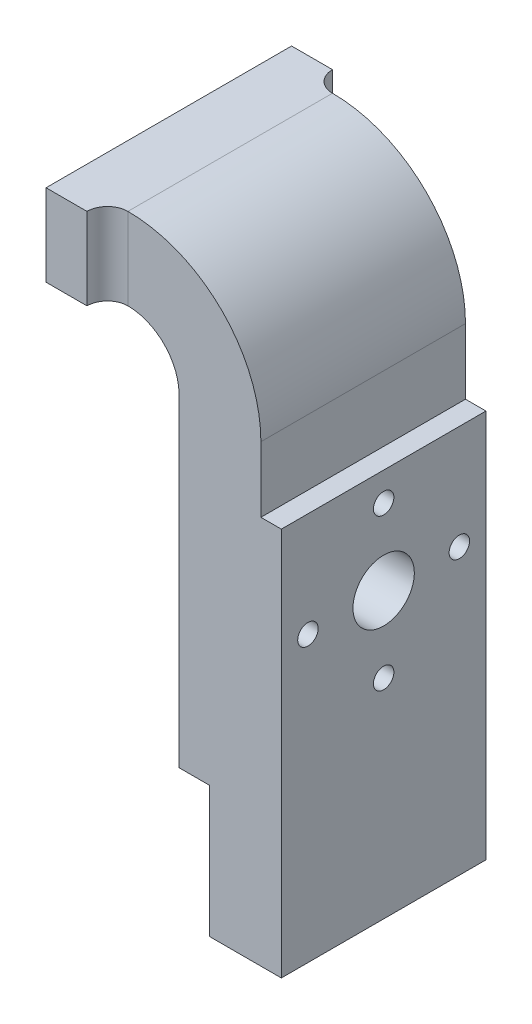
SolidWorks part; units mm, degrees
ref_plane "Front Plane" through (0, 0, 0) normal (0, 0, 1) x (1, 0, 0)
ref_plane "Top Plane" through (0, 0, 0) normal (0, 1, 0) x (1, 0, 0)
ref_plane "Right Plane" through (0, 0, 0) normal (1, 0, 0) x (0, 0, -1)
sketch "Sketch1" plane through (0, 0, 0) normal (0, 0, 1) x (1, 0, 0)
  line L0 (132.5, 64) -> (147.5, 64)
  line L1 (132.5, 222) -> (132.5, 64)
  line L2 (147.5, 0) -> (182.5, 0)
  line L3 (182.5, 190) -> (182.5, 0)
  line L4 (172.5, 222) -> (172.5, 190)
  line L5 (172.5, 190) -> (182.5, 190)
  line L6 (107.5, 287) -> (77.5, 287)
  line L7 (77.5, 287) -> (77.5, 247)
  line L8 (77.5, 247) -> (107.5, 247)
  line L9 (147.5, 64) -> (147.5, 0)
  line L10 (147.5, 0) -> (147.5, 64) construction
  line L11 (147.5, 64) -> (127.5, 64) construction
  line L14 (-147.5, 0) -> (147.5, 0) construction
  arc A0 (132.5, 222) -> (107.5, 247) centre (107.5, 222) ccw
  arc A1 (172.5, 222) -> (107.5, 287) centre (107.5, 222) ccw
  dimension "D1" = 50
  dimension "D2" = 65
  dimension "D3" = 30
  dimension "D4" = 15
  dimension "D5" = 35
  dimension "D6" = 190
  dimension "D9" = 32
extrude "Boss-Extrude1" add sketch "Sketch1" along normal mid plane 100
sketch "Sketch2" plane through (0, 0, 50) normal (0, 0, 1) x (1, 0, 0)
  line L0 (77.5, 247) -> (107.5, 247) construction
  line L1 (77.5, 287) -> (97.5, 287)
  line L2 (77.5, 287) -> (77.5, 247)
  line L3 (77.5, 247) -> (97.5, 247)
  line L4 (97.5, 287) -> (97.5, 247)
  dimension "D1" = 20
extrude "Boss-Extrude2" add sketch "Sketch2" along normal blind 10
mirror "Mirror1" about plane through (0, 0, 0) normal (0, 0, 1) of "Boss-Extrude2"
fillet "Fillet1" radius 10 2 edges
hole_wizard "M12x1.5 Tapped Hole1" positions "Sketch6" profile "Sketch5" tap size "M12x1.5" standard "ANSI Metric"
sketch "Sketch6" plane through (77.5, 0, 0) normal (-1, 0, 0) x (0, 0, 1)
  line L0 (0, 0) -> (0, 276.3928) construction
  line L2 (60, 287) -> (-60, 287) construction
  point P0 (-35, 267)
  point P2 (35, 267)
  dimension "D1" = 70
  dimension "D2" = 20
sketch "Sketch5" plane through (77.5, 267, -35) normal (0, 1, 0) x (0, 0, 1)
  line L0 (0, 0) -> (0, 31.6545)
  line L1 (0, 31.6545) -> (5.25, 28.5)
  line L2 (5.25, 28.5) -> (5.25, 0)
  line L5 (5.25, 0) -> (0, 0)
  line L10 (0, 31.6545) -> (-5.25, 28.5) construction
  line L11 (0, -6.35) -> (0, 107.95) construction
  dimension "Tap Drill Dia." = 10.5
  dimension "Tap Drill Depth" = 28.5
  dimension "Drill Angle" = 118
sketch "Sketch7" plane through (182.5, 0, 0) normal (1, 0, 0) x (0, 0, -1)
  circle A0 centre (0, 139) radius 15 construction
  circle A1 centre (0, 139) radius 15
extrude "Cut-Extrude1" cut sketch "Sketch7" against normal through all
sketch "Sketch8" plane through (182.5, 0, 0) normal (1, 0, 0) x (0, 0, -1)
  circle A4 centre (0, 102) radius 5
  circle A5 centre (-37, 139) radius 5
  circle A6 centre (0, 176) radius 5
  circle A7 centre (37, 139) radius 5
  circle A8 centre (0, 139) radius 37 construction
  dimension "D1" = 74
  dimension "D2" = 10
extrude "Cut-Extrude2" cut sketch "Sketch8" against normal through all
